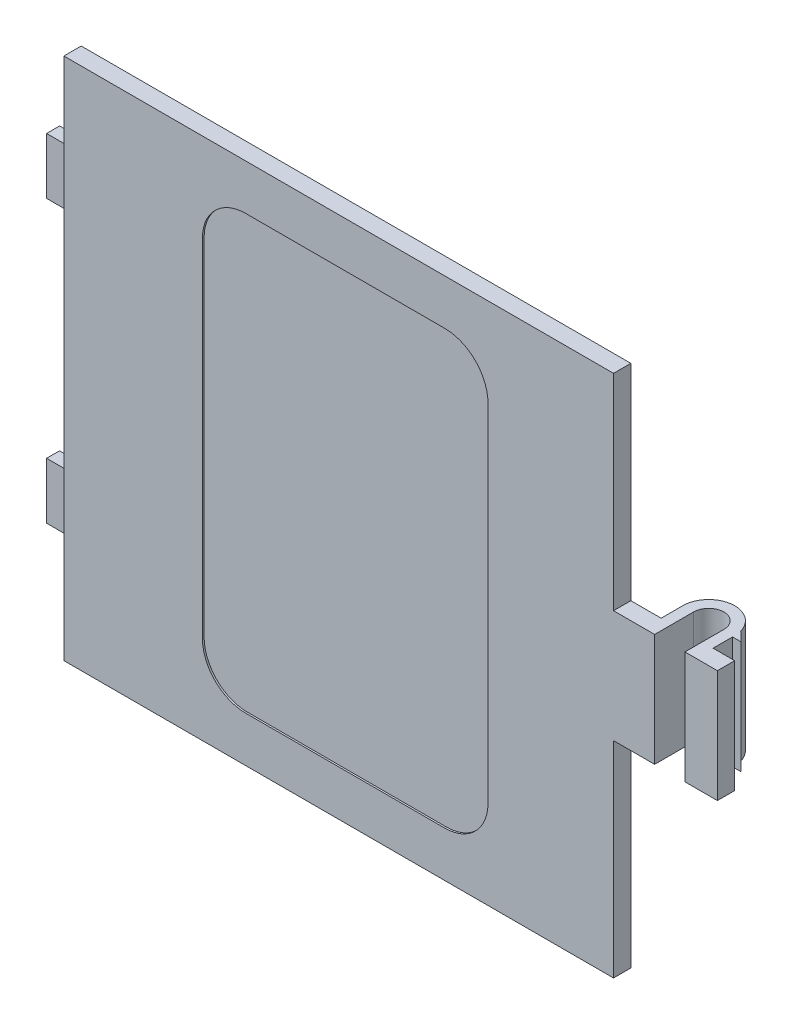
SolidWorks part; units mm, degrees
ref_plane "XZ (Face)" through (0, 0, 0) normal (0, 0, 1) x (1, 0, 0)
ref_plane "Plan médian" through (0, 0, 0) normal (0, 1, 0) x (1, 0, 0)
ref_plane "YZ (Droite)" through (0, 0, 0) normal (1, 0, 0) x (0, 0, -1)
sketch "Esquisse1" plane through (0, 0, 0) normal (0, 0, 1) x (1, 0, 0)
  line L8 (21.75, -10) -> (21.75, -30.25)
  line L9 (-41.75, 30.25) -> (22, 30.25)
  line L10 (21.75, -30.25) -> (-41.75, -30.25)
  line L11 (-41.75, -30.25) -> (-41.75, 30.25)
  line L12 (21.75, 30.25) -> (21.75, -30.25)
  line L13 (-41.75, 30.25) -> (21.75, 30.25)
  line L14 (21.75, -30.25) -> (-41.75, -30.25)
  line L15 (-41.75, -30.25) -> (-41.75, 30.25)
  dimension "D1" = 0.25
extrude "Base-Extrusion" add sketch "Esquisse1" against normal up to surface (2 mm away)
sketch "Esquisse2" plane through (0, 0, 0) normal (0, -1, 0) x (1, 0, 0)
  line L0 (21.75, -2) -> (21.75, 0) construction
  line L1 (21.75, -2) -> (21.75, 0)
  line L2 (21.75, 0) -> (26.5, 0)
  line L3 (21.75, -2) -> (25.25, -2)
  line L4 (26.5, 0) -> (26.5, -4.5)
  line L5 (25.25, -2) -> (25.25, -4.5)
  line L6 (30, -4.5) -> (30, 0)
  line L7 (30, 0) -> (33.75, 0)
  line L8 (33.75, 0) -> (33.75, -2)
  line L9 (33.75, -2) -> (31.25, -2)
  line L10 (31.25, -2) -> (31.25, -4.25)
  line L11 (31.25, -4.25) -> (32.25, -4.25)
  line L12 (32.25, -4.25) -> (31.25, -5.25)
  line L13 (31.25, -5.25) -> (31.1547, -5.25)
  line L14 (28.25, -4.5) -> (28.25, -13.5) construction
  arc A0 (26.5, -4.5) -> (30, -4.5) centre (28.25, -4.5) ccw
  arc A1 (25.25, -4.5) -> (31.1547, -5.25) centre (28.25, -4.5) ccw
  dimension "D1" = 3.5
  dimension "D2" = 6
  dimension "D3" = 4.5
  dimension "D4" = 6.5
  dimension "D5" = 12
  dimension "D6" = 1
  dimension "D7" = 1
  dimension "D8" = 45
  dimension "D9" = 2.25
extrude "Boss.-Extru.1" add sketch "Esquisse2" along normal blind 6.5 and the other way blind 6.5
ref_plane "Plan1" through (0, 13, 0) normal (0, 1, 0) x (-1, 0, 0)
sketch "Esquisse3" plane through (0, 13, 0) normal (0, 1, 0) x (-1, 0, 0)
  line L0 (-21.75, -2) -> (41.75, -2) construction
  line L1 (39.75, -2) -> (45.75, -2)
  line L2 (39.75, -2) -> (39.75, -3.5)
  line L3 (39.75, -3.5) -> (45.75, -3.5)
  line L4 (45.75, -2) -> (45.75, -3.5)
  line L6 (41.75, -2) -> (41.75, 0) construction
  dimension "D1" = 1.5
  dimension "D2" = 2
  dimension "D3" = 6
extrude "Boss.-Extru.2" add sketch "Esquisse3" along normal blind 6.5
mirror "Symétrie1" about plane through (0, 0, 0) normal (0, 1, 0) of "Boss.-Extru.2"
sketch "Esquisse4" plane through (0, 0, 0) normal (0, 0, 1) x (1, 0, 0)
  line L0 (0, 0) -> (-46.7, 0) construction
  line L1 (-25.75, -20) -> (-25.75, 20)
  line L2 (-20.75, 25) -> (2.25, 25)
  line L3 (7.25, 20) -> (7.25, -20)
  line L4 (-20.75, -25) -> (2.25, -25)
  line L6 (-41.75, 30.25) -> (-41.75, -30.25) construction
  arc A0 (-20.75, 25) -> (-25.75, 20) centre (-20.75, 20) ccw
  arc A1 (7.25, 20) -> (2.25, 25) centre (2.25, 20) ccw
  arc A2 (7.25, -20) -> (2.25, -25) centre (2.25, -20) cw
  arc A3 (-20.75, -25) -> (-25.75, -20) centre (-20.75, -20) cw
  point P5 (-25.75, 0)
  point P17 (7.25, 0)
  dimension "D4" = 5
  dimension "D1" = 33
  dimension "D2" = 50
  dimension "D3" = 16
extrude "Enlèv. mat.-Extru.1" cut sketch "Esquisse4" against normal blind 0.2
